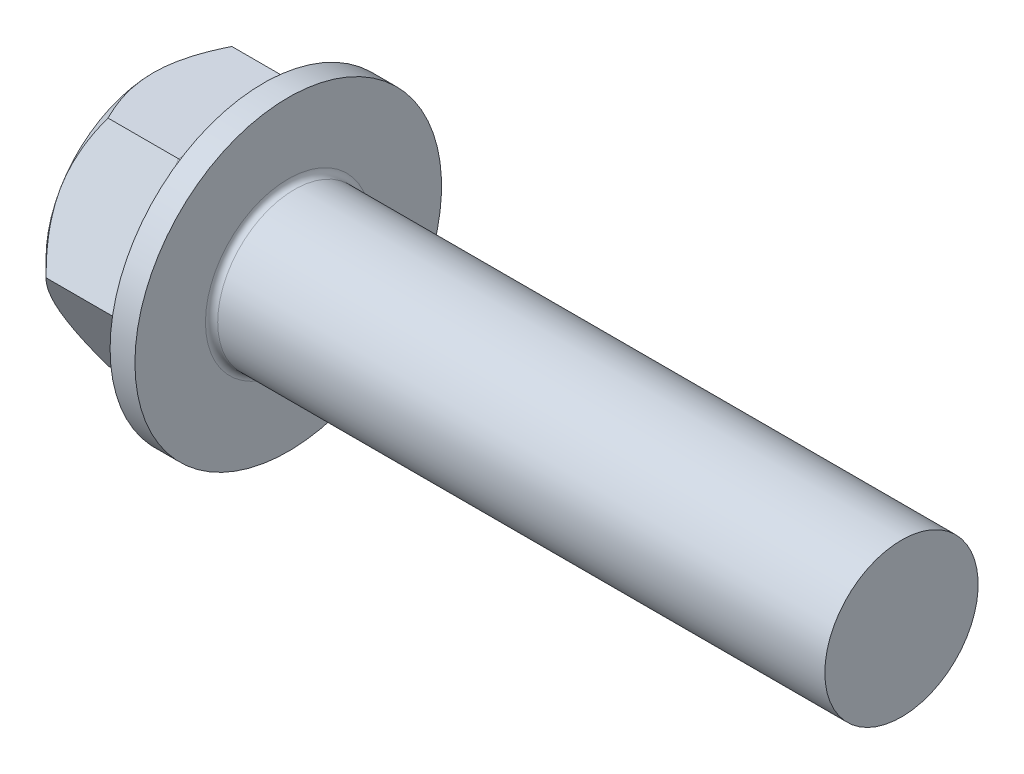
SolidWorks part; units mm, degrees
ref_plane "Front Plane" through (0, 0, 0) normal (0, 0, 1) x (1, 0, 0)
ref_plane "Top Plane" through (0, 0, 0) normal (0, 1, 0) x (1, 0, 0)
ref_plane "Right Plane" through (0, 0, 0) normal (1, 0, 0) x (0, 0, -1)
sketch "BodySke" plane through (0, 0, 0) normal (0, 0, 1) x (1, 0, 0)
  line L0 (0, 0) -> (111.3824, 0) construction
  line L1 (0, 0) -> (0, 7)
  line L2 (7.18, 10) -> (8.8, 10)
  line L3 (8.8, 10) -> (8.8, 5)
  line L4 (8.8, 5) -> (48.8, 5)
  line L5 (48.8, 5) -> (48.8, 0)
  line L6 (10.3, 8.824) -> (10.3, -5.8939) construction
  line L7 (0, 0) -> (48.8, 0)
  line L8 (11.8, 8.824) -> (11.8, -4.958) construction
  line L9 (7.18, 10) -> (7.18, 7)
  line L10 (7.18, 7) -> (0, 7)
  point P10 (48.8, 4.172)
  dimension "Diameter" = 10
  dimension "dc" = 20
  dimension "Head_height" = 7.18
  dimension "Length" = 40
  dimension "Advance" = 1.5
  dimension "Thread_minor" = 8.344
  dimension "Thread_runout" = 3
  dimension "Head_dia" = 14
  dimension "c" = 1.62
revolve "BaseBody" add sketch "BodySke" angle 360 about L0
sketch "HeadSke" plane through (0, 0, 0) normal (1, 0, 0) x (0, 0, -1)
  line L1 (8.0829, 0) -> (4.0415, 7)
  line L2 (4.0415, 7) -> (-4.0415, 7)
  line L3 (-4.0415, 7) -> (-8.0829, 0)
  line L4 (-8.0829, 0) -> (-4.0415, -7)
  line L5 (-4.0415, -7) -> (4.0415, -7)
  line L6 (4.0415, -7) -> (8.0829, 0)
  circle A0 centre (0, 0) radius 7 construction
  circle A1 centre (0, 0) radius 7 construction
extrude "Head" add sketch "HeadSke" along normal up to next
sketch "Sketch2" plane through (0, 0, 0) normal (0, 1, 0) x (1, 0, 0)
  line L1 (-2, 7) -> (0, 7)
  line L2 (-2, 7) -> (-2, 10)
  line L3 (-2, 10) -> (1.0829, 10)
  line L4 (1.0829, 8.0829) -> (1.0829, 10)
  line L6 (0, 0) -> (-11.6831, 0) construction
  line L7 (0, 7) -> (1.0829, 8.0829)
  line L9 (7.18, 8.0829) -> (0, 8.0829) construction
  dimension "D1" = 10
  dimension "D2" = 2
  dimension "D3" = 45
revolve "Cut-Revolve1" cut sketch "Sketch2" angle 360 about L6
sketch "Sketch3" plane through (0, 0, 0) normal (1, 0, 0) x (0, 0, -1)
  circle A0 centre (0, 0) radius 5.95
  dimension "D1" = 11.9
extrude "Extrude3" cut sketch "Sketch3" along normal blind 1.436
sketch "ThdSchSke" plane through (0, 0, 0) normal (0, 0, 1) x (1, 0, 0)
  line L0 (0, 0) -> (55.1256, 0) construction
  line L1 (0, 0) -> (111.3824, 0) construction
  line L2 (48.322, 5) -> (48.322, 5.9561)
  line L3 (48.322, 5.9561) -> (49.278, 5.9561)
  line L4 (49.278, 5.9561) -> (49.278, 5)
  line L5 (49.278, 5) -> (48.8, 4.172)
  line L6 (48.8, 4.172) -> (48.322, 5)
  line L7 (8.8, 5) -> (48.8, 5) construction
  line L13 (48.8, 5) -> (48.8, 0) construction
revolve "ThreadSchematic" [suppressed] cut sketch "ThdSchSke" angle 360 about L0
pattern_linear "ThdSchPat" [suppressed] count 25 along (1, 0, 0)
fillet "Fillet1" radius 1.5 6 edges at (7.18, 3.5, -6.0622) (7.18, -3.5, -6.0622) (7.18, -7, 0) (7.18, -3.5, 6.0622) (7.18, 7, 0) (7.18, 3.5, 6.0622)
fillet "Fillet2" radius 0.4 1 edges at (8.8, 0, 5)
equation "\"Thread_minor@ThreadCosmetic\" = \"Thread_minor@BodySke\""
equation "\"Advance@ThdSchPat\" = \"Advance@BodySke\""
equation "\"D1@ThdSchPat\" =  int(  ( \"Length@BodySke\" - \"Thread_runout@BodySke\" )  / \"Advance@ThdSchPat\" )  + 1"
equation "\"D1@Sketch3\" = \"Head_dia@BodySke\" * 0.85"
equation "\"D1@Extrude3\" = \"Head_height@BodySke\" * 0.2"
